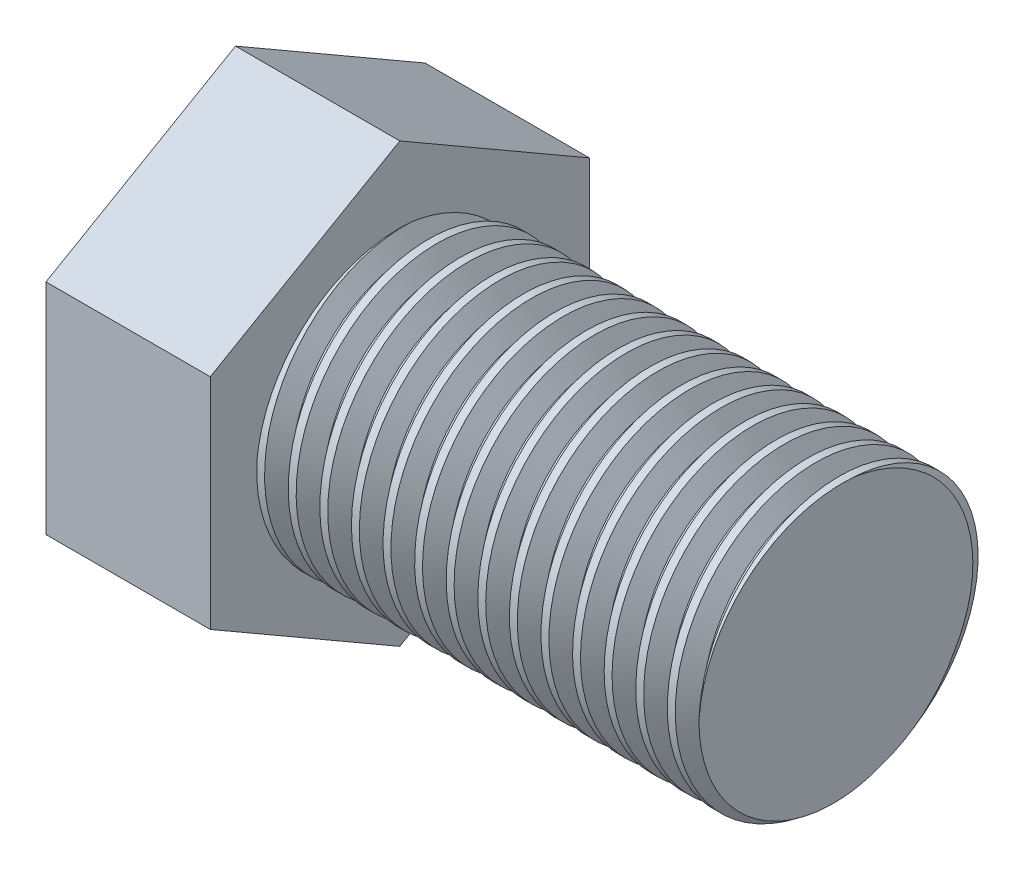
SolidWorks part; units mm, degrees
ref_plane "Front Plane" through (0, 0, 0) normal (0, 0, 1) x (1, 0, 0)
ref_plane "Top Plane" through (0, 0, 0) normal (0, 1, 0) x (1, 0, 0)
ref_plane "Right Plane" through (0, 0, 0) normal (1, 0, 0) x (0, 0, -1)
sketch "Sketch1" plane through (0, 0, 0) normal (1, 0, 0) x (0, -1, 0)
  circle A0 centre (0, 0) radius 10
  dimension "D1" = 20
extrude "Boss-Extrude1" add sketch "Sketch1" along normal blind 35
sketch "Sketch4" plane through (0, 0, 0) normal (-1, 0, 0) x (0, -1, 0)
  line L1 (17.3205, 0) -> (8.6603, 15)
  line L2 (8.6603, 15) -> (-8.6603, 15)
  line L3 (-8.6603, 15) -> (-17.3205, 0)
  line L4 (-17.3205, 0) -> (-8.6603, -15)
  line L5 (-8.6603, -15) -> (8.6603, -15)
  line L6 (8.6603, -15) -> (17.3205, 0)
  circle A0 centre (0, 0) radius 15 construction
  dimension "D1" = 30
extrude "Boss-Extrude2" add sketch "Sketch4" along normal blind 13
thread "Thread1" pitch 2.5 start angle 0, offset 2, length 0, pitch 2.5, diameter 20
ref_plane "Plane1" through (-2, 0, -10) normal (0, 1, 0) x (0, 0, 1)
sketch "Thread Profile1" plane through (-2, 0, -10) normal (0, 1, 0) x (0, 0, 1)
  line L0 (0, 0) -> (0, 2.5) construction
  line L11 (0, 0) -> (0, 2.1875)
  line L12 (0, 2.1875) -> (-1.3532, 1.4062)
  line L13 (-1.3532, 1.4062) -> (-1.3532, 0.7812)
  line L15 (-1.3532, 0.7812) -> (0, 0)
  line L17 (-1.3532, 1.0937) -> (0, 1.0937) construction
  point P2 (0, 0)
  dimension "Pitch" = 2.5
  dimension "Profile_Angle" = 60
  dimension "Profile_Land" = 0.625
  dimension "Profile_Height" = 1.3532
